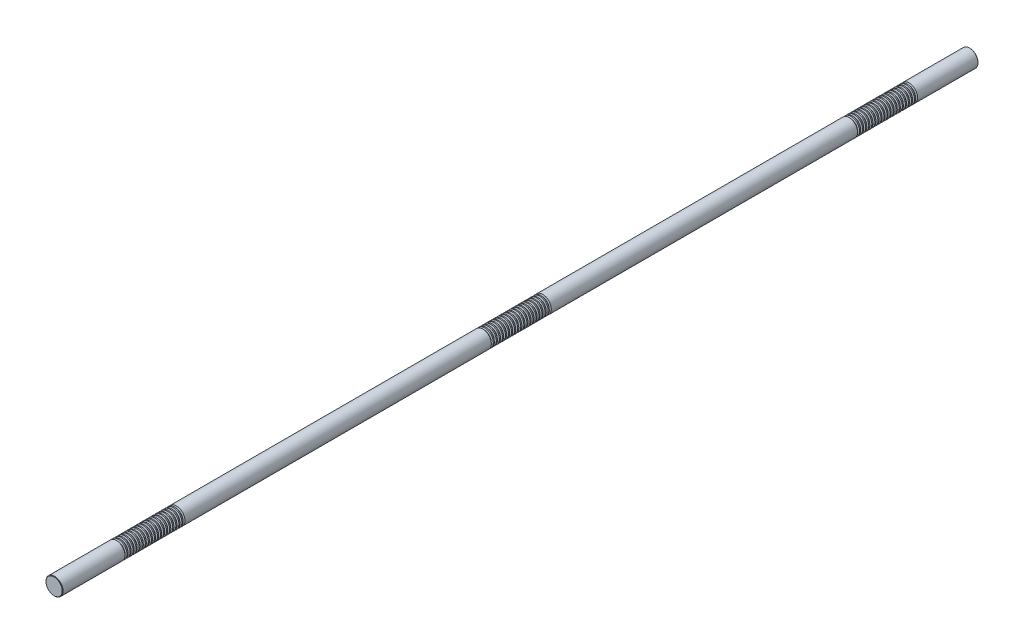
SolidWorks part; units mm, degrees
ref_plane "Front Plane" through (0, 0, 0) normal (0, 0, 1) x (1, 0, 0)
ref_plane "Top Plane" through (0, 0, 0) normal (0, 1, 0) x (1, 0, 0)
ref_plane "Right Plane" through (0, 0, 0) normal (1, 0, 0) x (0, 0, -1)
sketch "Sketch1" plane through (0, 0, 0) normal (0, 0, 1) x (1, 0, 0)
  circle A0 centre (0, 0) radius 14
  dimension "D1" = 28
extrude "Boss-Extrude1" add sketch "Sketch1" along normal mid plane 1500
chamfer "Chamfer1" distance 0.7 angle 45 2 edges at (14, 0, -750) (14, 0, 750)
sketch "Sketch2" plane through (0, 0, 0) normal (1, 0, 0) x (0, 0, -1)
  line L0 (650.3684, 14) -> (647.1316, 14)
  line L1 (749.3, 14) -> (-749.3, 14) construction
  line L2 (647.1316, 14) -> (647.8684, 11.25)
  line L3 (647.8684, 11.25) -> (649.6316, 11.25)
  line L4 (649.6316, 11.25) -> (650.3684, 14)
  line L5 (750, -13.3) -> (750, 13.3) construction
  point P4 (648.75, 14)
  point P7 (648.75, 11.25)
  point P8 (650, 12.625)
  point P9 (647.5, 12.625)
  dimension "D1" = 2.5
  dimension "D2" = 100
  dimension "D3" = 2.75
  dimension "D4" = 30
revolve "Cut-Revolve1" cut sketch "Sketch2" angle 360 about axis through (0, 0, 750) along (0, 0, -1)
pattern_linear "LPattern1" count 20 spacing 5 along (0, 0, 1) of "Cut-Revolve1"
pattern_linear "LPattern2" count 3 spacing 600 along (0, 0, 1) of "Cut-Revolve1", "LPattern1"
